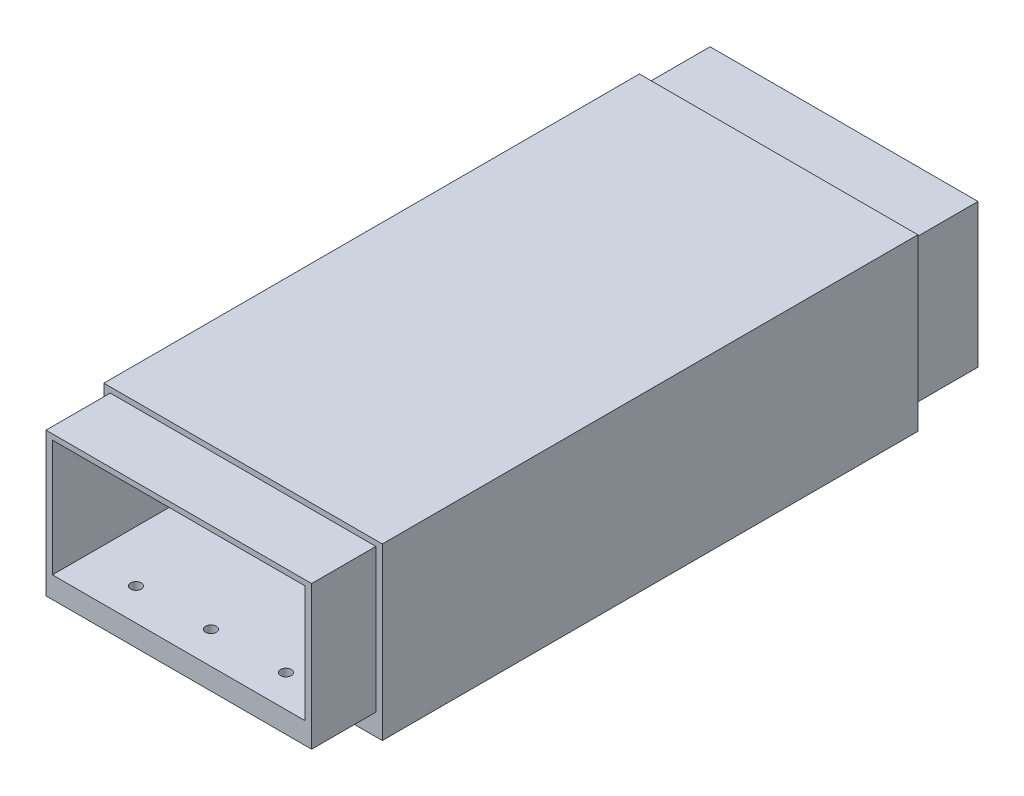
SolidWorks part; units mm, degrees
ref_plane "前视基准面" through (0, 0, 0) normal (0, 0, 1) x (1, 0, 0)
ref_plane "上视基准面" through (0, 0, 0) normal (0, 1, 0) x (1, 0, 0)
ref_plane "右视基准面" through (0, 0, 0) normal (1, 0, 0) x (0, 0, -1)
sketch "草图1" plane through (0, 0, 1400) normal (0, 0, 1) x (1, 0, 0)
  line L1 (-119.3024, 140.0174) -> (5.7729, 140.0174)
  line L2 (-119.3024, 140.0174) -> (-119.3024, 73.0247)
  line L3 (-119.3024, 73.0247) -> (5.7729, 73.0247)
  line L4 (5.7729, 140.0174) -> (5.7729, 73.0247)
  line L5 (-116.3024, 137.5174) -> (1.6976, 137.5174)
  line L6 (-116.3024, 137.5174) -> (-116.3024, 83.0247)
  line L7 (-116.3024, 83.0247) -> (1.6976, 83.0247)
  line L8 (1.6976, 137.5174) -> (1.6976, 83.0247)
extrude "凸台-拉伸1" add sketch "草图1" along normal up to surface (30 mm away)
sketch "草图2" plane through (0, 0, 1430) normal (0, 0, 1) x (1, 0, 0)
  line L1 (-122.3024, 63.0247) -> (7.6976, 63.0247)
  line L2 (-122.3024, 63.0247) -> (-122.3024, 142.5174)
  line L3 (-122.3024, 142.5174) -> (7.6976, 142.5174)
  line L4 (7.6976, 63.0247) -> (7.6976, 142.5174)
extrude "凸台-拉伸2" add sketch "草图2" along normal blind 250
sketch "草图3" plane through (0, 0, 1430) normal (0, 0, -1) x (-1, 0, 0)
  line L1 (-1.6976, 137.5174) -> (116.3024, 137.5174)
  line L2 (-1.6976, 137.5174) -> (-1.6976, 83.0247)
  line L3 (-1.6976, 83.0247) -> (116.3024, 83.0247)
  line L4 (116.3024, 137.5174) -> (116.3024, 83.0247)
extrude "切除-拉伸1" cut sketch "草图3" against normal up to next
sketch "草图4" plane through (0, 0, 1680) normal (0, 0, 1) x (1, 0, 0)
  line L0 (-122.3024, 142.5174) -> (-122.3024, 63.0247) construction
  line L1 (-119.3024, 140.0174) -> (4.6976, 140.0174)
  line L2 (-119.3024, 140.0174) -> (-119.3024, 73.0247)
  line L3 (-119.3024, 73.0247) -> (4.6976, 73.0247)
  line L4 (4.6976, 140.0174) -> (4.6976, 73.0247)
  line L5 (7.6976, 63.0247) -> (7.6976, 142.5174) construction
  line L6 (7.6976, 142.5174) -> (-122.3024, 142.5174) construction
  line L7 (-122.3024, 63.0247) -> (7.6976, 63.0247) construction
  line L9 (-116.3024, 137.5174) -> (1.6976, 137.5174)
  line L10 (-116.3024, 137.5174) -> (-116.3024, 83.0247)
  line L11 (-116.3024, 83.0247) -> (1.6976, 83.0247)
  line L12 (1.6976, 137.5174) -> (1.6976, 83.0247)
  dimension "D1" = 3
  dimension "D2" = 3
  dimension "D3" = 2.5
  dimension "D4" = 10
extrude "凸台-拉伸3" add sketch "草图4" along normal blind 30
sketch "草图5" plane through (0, 73.0247, 0) normal (0, -1, 0) x (1, 0, 0)
  circle A0 centre (-92.3024, 1415) radius 2.5
  circle A1 centre (-57.3024, 1415) radius 2.5
  circle A2 centre (-22.3024, 1415) radius 2.5
extrude "切除-拉伸2" cut sketch "草图5" against normal up to next
sketch "草图6" plane through (0, 73.0247, 0) normal (0, -1, 0) x (1, 0, 0)
  circle A0 centre (-92.3024, 1695) radius 2.5
  circle A1 centre (-57.3024, 1695) radius 2.5
  circle A2 centre (-22.3024, 1695) radius 2.5
extrude "切除-拉伸3" cut sketch "草图6" against normal up to next
